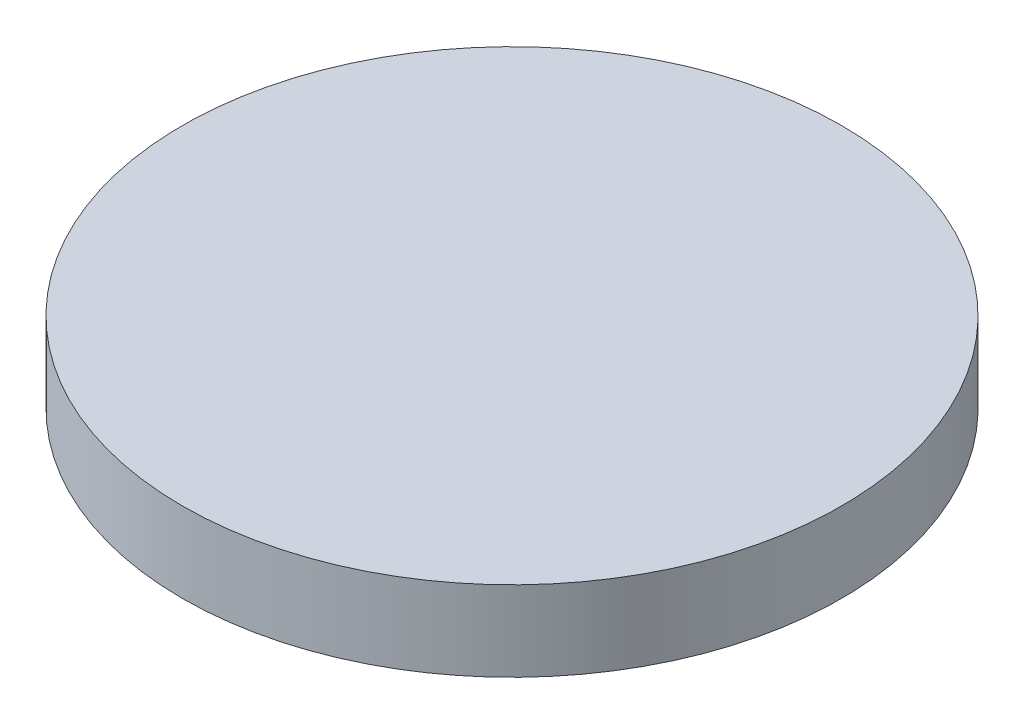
SolidWorks part; units mm, degrees
ref_plane "Front Plane" through (0, 0, 0) normal (0, 0, 1) x (1, 0, 0)
ref_plane "Top Plane" through (0, 0, 0) normal (0, 1, 0) x (1, 0, 0)
ref_plane "Right Plane" through (0, 0, 0) normal (1, 0, 0) x (0, 0, -1)
sketch "Sketch1" plane through (0, 0, 0) normal (0, 1, 0) x (1, 0, 0)
  circle A0 centre (0, 0) radius 57.4675
  dimension "D1" = 114.935
extrude "Boss-Extrude1" add sketch "Sketch1" along normal blind 13.97
